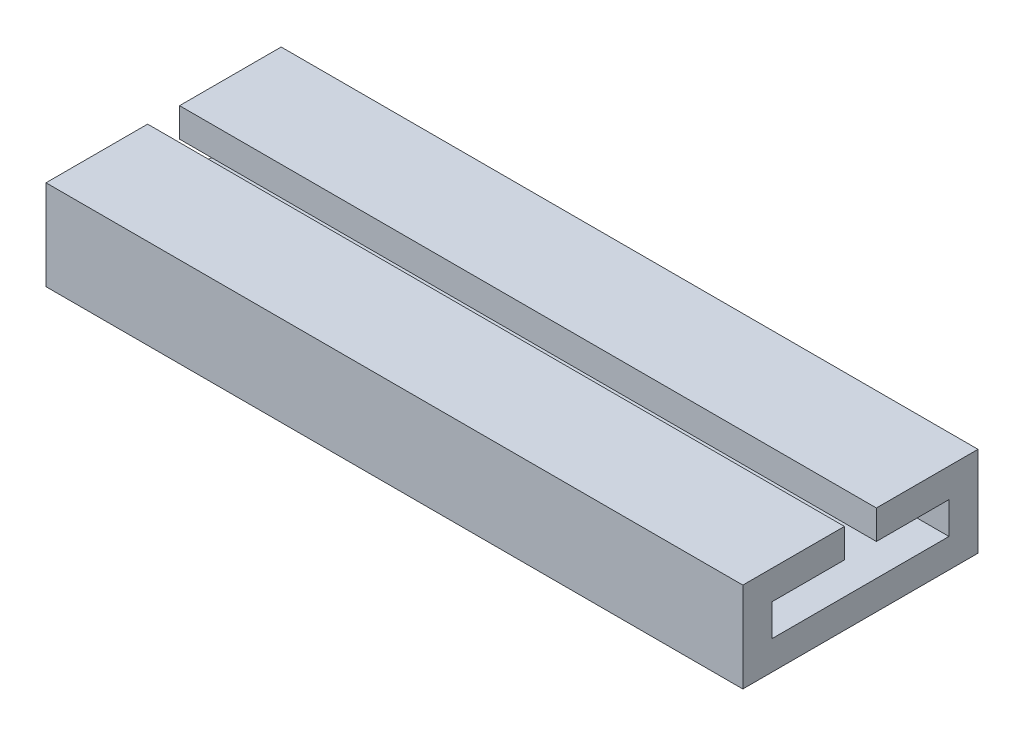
SolidWorks part; units mm, degrees
ref_plane "Front Plane" through (0, 0, 0) normal (0, 0, 1) x (1, 0, 0)
ref_plane "Top Plane" through (0, 0, 0) normal (0, 1, 0) x (1, 0, 0)
ref_plane "Right Plane" through (0, 0, 0) normal (1, 0, 0) x (0, 0, -1)
sketch "Sketch1" plane through (0, 0, 0) normal (1, 0, 0) x (0, 0, -1)
  line L1 (-20.25, -7.75) -> (20.25, -7.75)
  line L2 (-20.25, -7.75) -> (-20.25, 7.75)
  line L3 (-20.25, 7.75) -> (20.25, 7.75)
  line L4 (20.25, -7.75) -> (20.25, 7.75)
  line L5 (-20.25, -7.75) -> (20.25, 7.75) construction
  line L6 (-20.25, 7.75) -> (20.25, -7.75) construction
  line L7 (-15.25, -2.75) -> (15.25, -2.75)
  line L8 (-15.25, -2.75) -> (-15.25, 2.75)
  line L9 (-15.25, 2.75) -> (15.25, 2.75)
  line L10 (15.25, -2.75) -> (15.25, 2.75)
  line L11 (-15.25, -2.75) -> (15.25, 2.75) construction
  line L12 (-15.25, 2.75) -> (15.25, -2.75) construction
  point P0 (0, 0)
  point P5 (0, 0)
  dimension "D1" = 30.5
  dimension "D2" = 5.5
  dimension "D3" = 5
  dimension "D4" = 5
extrude "Boss-Extrude1" add sketch "Sketch1" along normal blind 120 contours L2 L1 L4 L3
sketch "Sketch2" plane through (120, 0, 0) normal (1, 0, 0) x (0, 0, -1)
  line L0 (-20.25, 7.75) -> (20.25, 7.75) construction
  line L1 (15.25, 2.75) -> (-15.25, 2.75)
  line L2 (15.25, 2.75) -> (15.25, -2.75)
  line L3 (15.25, -2.75) -> (-15.25, -2.75)
  line L4 (-15.25, 2.75) -> (-15.25, -2.75)
  line L5 (15.25, 2.75) -> (-15.25, -2.75) construction
  line L6 (15.25, -2.75) -> (-15.25, 2.75) construction
  line L7 (-20.25, -7.75) -> (-20.25, 7.75) construction
  point P0 (0, 0)
  dimension "D1" = 5
  dimension "D2" = 5
extrude "Cut-Extrude1" cut sketch "Sketch2" against normal through all contours L2 L1 L4 L3
sketch "Sketch3" plane through (0, 0, 0) normal (-1, 0, 0) x (0, 0, 1)
  line L0 (20.25, 7.75) -> (-20.25, 7.75) construction
  line L1 (-2.75, 7.75) -> (2.75, 7.75)
  line L2 (-2.75, 7.75) -> (-2.75, 2.75)
  line L3 (-2.75, 2.75) -> (2.75, 2.75)
  line L4 (2.75, 7.75) -> (2.75, 2.75)
  line L5 (-15.25, 2.75) -> (15.25, 2.75) construction
  line L6 (-2.75, 5.25) -> (-20.25, 5.25) construction
  line L7 (-20.25, -7.75) -> (-20.25, 7.75) construction
  line L8 (2.75, 5.25) -> (20.25, 5.25) construction
  line L9 (20.25, -7.75) -> (20.25, 7.75) construction
  dimension "D1" = 5.5
extrude "Cut-Extrude2" cut sketch "Sketch3" against normal through all contours L2 L1 L4 L3
sketch "Sketch4" plane through (0, -2.75, 0) normal (0, 1, 0) x (1, 0, 0)
  line L0 (120, 2.75) -> (0, 2.75) construction
  line L1 (10, 2.75) -> (110, 2.75)
  line L2 (10, 2.75) -> (10, -2.75)
  line L3 (10, -2.75) -> (110, -2.75)
  line L4 (110, 2.75) -> (110, -2.75)
  line L5 (120, -2.75) -> (0, -2.75) construction
  line L6 (120, 15.25) -> (120, -15.25) construction
  dimension "D1" = 10
  dimension "D2" = 10
extrude "Cut-Extrude3" cut sketch "Sketch4" against normal through all contours L2 L1 L4 L3
